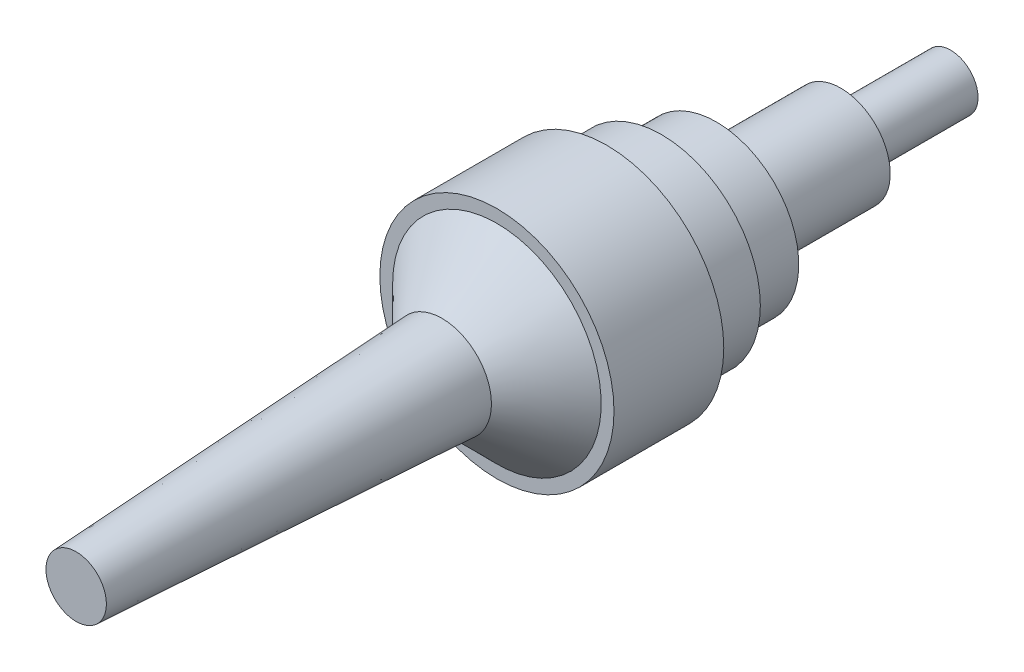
SolidWorks part; units mm, degrees
ref_plane "Front Plane" through (0, 0, 0) normal (0, 0, 1) x (1, 0, 0)
ref_plane "Top Plane" through (0, 0, 0) normal (0, 1, 0) x (1, 0, 0)
ref_plane "Right Plane" through (0, 0, 0) normal (1, 0, 0) x (0, 0, -1)
sketch "Sketch1" plane through (0, 0, 0) normal (0, 0, 1) x (1, 0, 0)
  circle A0 centre (0, 0) radius 1.35
  dimension "D1" = 2.7
extrude "Boss-Extrude1" add sketch "Sketch1" along normal blind 10 draft 3
sketch "Sketch2" plane through (0, 0, 0) normal (0, 0, -1) x (-1, 0, 0)
  circle A0 centre (0, 0) radius 1.35
  dimension "D1" = 2.7
extrude "Boss-Extrude2" add sketch "Sketch2" along normal blind 1.5 draft 45
sketch "Sketch3" plane through (0, 0, -1.5) normal (0, 0, -1) x (-1, 0, 0)
  circle A0 centre (0, 0) radius 3.2
  dimension "D1" = 6.4
extrude "Boss-Extrude3" add sketch "Sketch3" along normal blind 3
sketch "Sketch4" plane through (0, 0, -4.5) normal (0, 0, -1) x (-1, 0, 0)
  circle A0 centre (0, 0) radius 2.7
  dimension "D1" = 5.4
extrude "Boss-Extrude4" add sketch "Sketch4" along normal blind 1.5
sketch "Sketch5" plane through (0, 0, -6) normal (0, 0, -1) x (-1, 0, 0)
  circle A0 centre (0, 0) radius 2.25
  dimension "D1" = 4.5
extrude "Boss-Extrude5" add sketch "Sketch5" along normal blind 1.5
sketch "Sketch6" plane through (0, 0, -7.5) normal (0, 0, -1) x (-1, 0, 0)
  circle A0 centre (0, 0) radius 1.35
  dimension "D1" = 2.7
extrude "Boss-Extrude6" add sketch "Sketch6" along normal blind 3.4
sketch "Sketch7" plane through (0, 0, -10.9) normal (0, 0, -1) x (-1, 0, 0)
  circle A0 centre (0, 0) radius 0.75
  dimension "D1" = 1.5
extrude "Boss-Extrude7" add sketch "Sketch7" along normal blind 3
